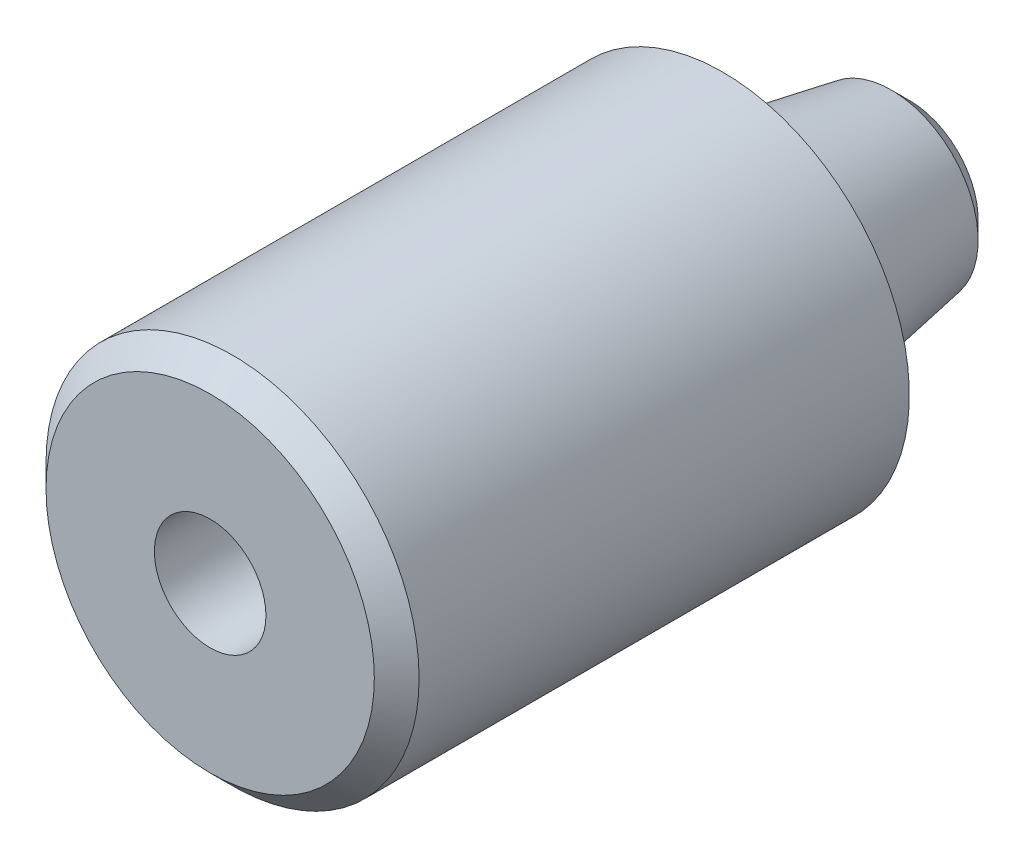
SolidWorks part; units mm, degrees
ref_plane "Front Plane" through (0, 0, 0) normal (0, 0, 1) x (1, 0, 0)
ref_plane "Top Plane" through (0, 0, 0) normal (0, 1, 0) x (1, 0, 0)
ref_plane "Right Plane" through (0, 0, 0) normal (1, 0, 0) x (0, 0, -1)
sketch "Sketch1" plane through (0, 0, 0) normal (1, 0, 0) x (0, 0, -1)
  line L0 (0, 0) -> (-0.9212, 0) construction
  line L1 (55, 0) -> (-55, 0) construction
  line L2 (0, 0) -> (0, 6.35)
  line L3 (0, 55) -> (0, -55) construction
  line L4 (0, 6.35) -> (17.4498, 6.35)
  line L5 (17.4498, 6.35) -> (17.4498, 3.9688)
  line L6 (17.4498, 3.9688) -> (23.7998, 2.8491)
  line L7 (23.7998, 2.8491) -> (23.7998, 0)
  line L8 (0, 0) -> (23.7998, 0)
  dimension "D1" = 12.7
  dimension "D2" = 7.9375
  dimension "D3" = 6.35
  dimension "D4" = 17.4498
  dimension "D5" = 10
revolve "Revolve1" add sketch "Sketch1" angle 360 about L0
chamfer "Chamfer1" distance 0.762 angle 45 1 edges at (-6.35, 0, 0)
chamfer "Chamfer2" distance 0.508 angle 45 1 edges at (-2.8491, 0, -23.7998)
hole_wizard "#10-24 Tapped Hole1" positions "Sketch3" profile "Sketch2" tap size "#10-24" standard "ANSI Inch"
sketch "Sketch3" plane through (0, 0, 0) normal (0, 0, 1) x (1, 0, 0)
  point P0 (0, 0)
sketch "Sketch2" plane through (0, 0, 0) normal (1, 0, 0) x (0, -1, 0)
  line L0 (0, 0) -> (0, 13.8408)
  line L1 (0, 13.8408) -> (1.8986, 12.7)
  line L2 (1.8986, 12.7) -> (1.8986, 0)
  line L5 (1.8986, 0) -> (0, 0)
  line L10 (0, 13.8408) -> (-1.8987, 12.7) construction
  line L11 (0, -6.35) -> (0, 28.682) construction
  dimension "Tap Drill Dia." = 3.7973
  dimension "Tap Drill Depth" = 12.7
  dimension "Drill Angle" = 118
